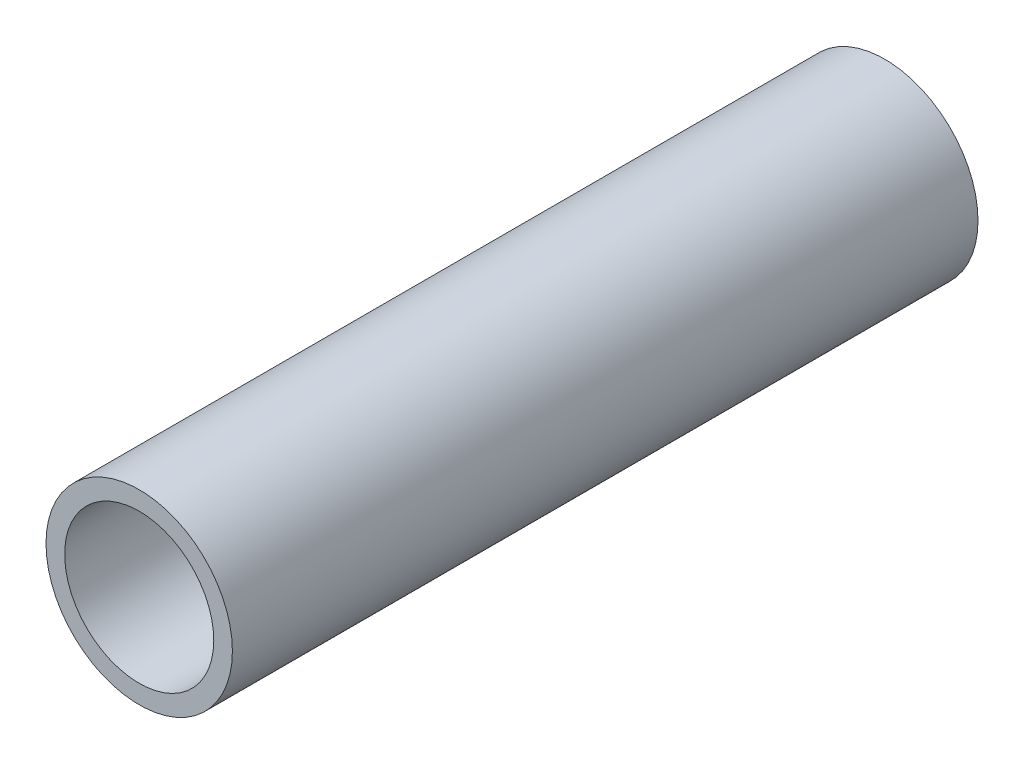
SolidWorks part; units mm, degrees
ref_plane "Face" through (0, 0, 0) normal (0, 0, 1) x (1, 0, 0)
ref_plane "Dessus" through (0, 0, 0) normal (0, 1, 0) x (1, 0, 0)
ref_plane "Droite" through (0, 0, 0) normal (1, 0, 0) x (0, 0, -1)
sketch "Esquisse1" plane through (0, 0, 0) normal (0, 0, 1) x (1, 0, 0)
  circle A0 centre (0, 0) radius 12.5
  circle A1 centre (0, 0) radius 10
  dimension "D1" = 25
  dimension "D2" = 20
extrude "Extrusion1" add sketch "Esquisse1" along normal blind 100
